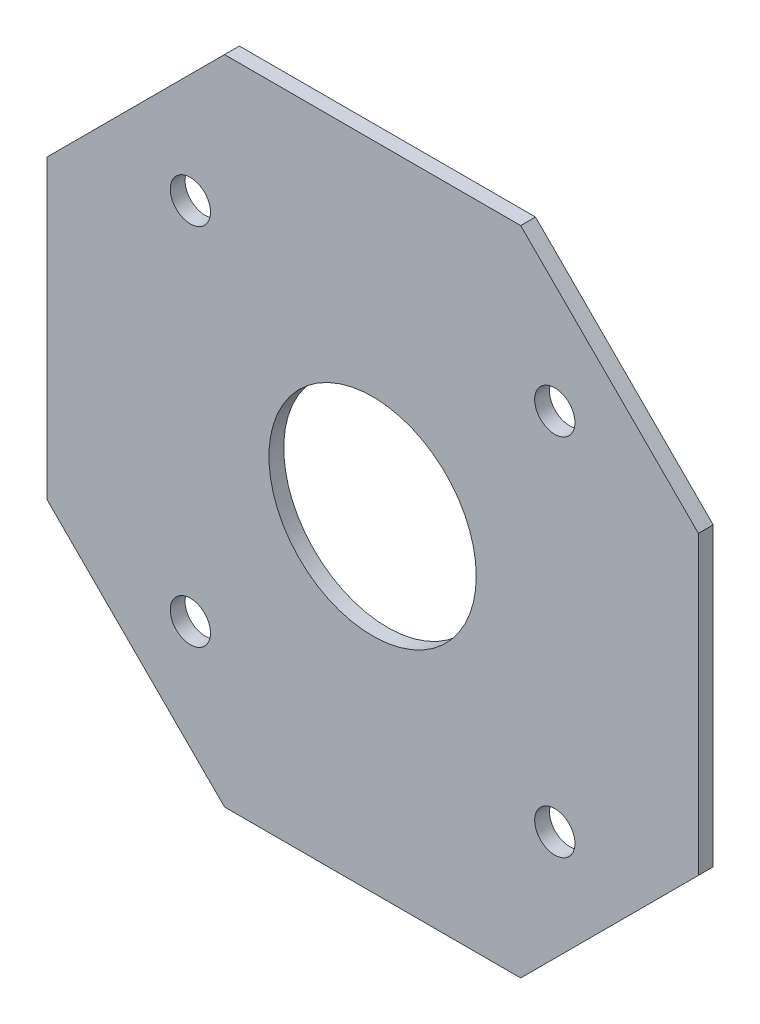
SolidWorks part; units mm, degrees
ref_plane "Plan de face" through (0, 0, 0) normal (0, 0, 1) x (1, 0, 0)
ref_plane "Plan de dessus" through (0, 0, 0) normal (0, 1, 0) x (1, 0, 0)
ref_plane "Plan de droite" through (0, 0, 0) normal (1, 0, 0) x (0, 0, -1)
sketch "Esquisse1" plane through (0, 0, 0) normal (0, 0, 1) x (1, 0, 0)
  line L0 (-55, 55) -> (55, -55) construction
  line L1 (-55, -55) -> (55, -55)
  line L2 (-55, -55) -> (-55, 55)
  line L3 (-55, 55) -> (55, 55)
  line L4 (55, -55) -> (55, 55)
  dimension "D1" = 110
  dimension "D2" = 110
sheet metal parameters "Tôlerie 1" thickness 2.5 parameters "D1"=2.5
base flange "Tôle de base pliée1" sketch "Esquisse1" thickness 2.5 reverse thickness direction yes parameters "D1"=2.5
break corner "Coin-brisé1" thickness 2.5 parameters "D1"=40, "D7"=5
sketch "Esquisse3" plane through (0, 0, 2.5) normal (0, 0, 1) x (1, 0, 0)
  circle A0 centre (0, 0) radius 17.5
  dimension "D1" = 35
extrude "Enlèv. mat.-Extru.1" cut sketch "Esquisse3" against normal through all
hole_wizard "Trou taraudé M81" positions "Esquisse5" profile "Esquisse4" tap size "M8" standard "ISO"
sketch "Esquisse5" plane through (0, 0, 2.5) normal (0, 0, 1) x (1, 0, 0)
  line L1 (-30.7591, 30.7591) -> (30.7591, 30.7591) construction
  line L2 (-30.7591, 30.7591) -> (-30.7591, -30.7591) construction
  line L3 (-30.7591, -30.7591) -> (30.7591, -30.7591) construction
  line L4 (30.7591, 30.7591) -> (30.7591, -30.7591) construction
  circle A0 centre (0, 0) radius 43.5 construction
  point P0 (-30.7591, 30.7591)
  point P1 (-30.7591, -30.7591)
  point P3 (30.7591, -30.7591)
  point P5 (30.7591, 30.7591)
  dimension "D1" = 87
sketch "Esquisse4" plane through (-30.7591, 30.7591, 2.5) normal (1, 0, 0) x (0, -1, 0)
  line L0 (0, 0) -> (0, 2.5)
  line L1 (0, 2.5) -> (3.4, 2.5)
  line L2 (3.4, 2.5) -> (3.4, 0)
  line L5 (3.4, 0) -> (0, 0)
  line L11 (0, -6.35) -> (0, 107.95) construction
  dimension "Diamètre du trou pour taraudage jusqu'au prochain" = 6.8
  dimension "Profondeur du trou pour taraudage jusqu'au prochain" = 2.5
flat pattern "Etat déplié1"
sketch "Lignes de pliage1" plane through (0, 0, 0) normal (0, 1, 0) x (-1, 0, 0)
